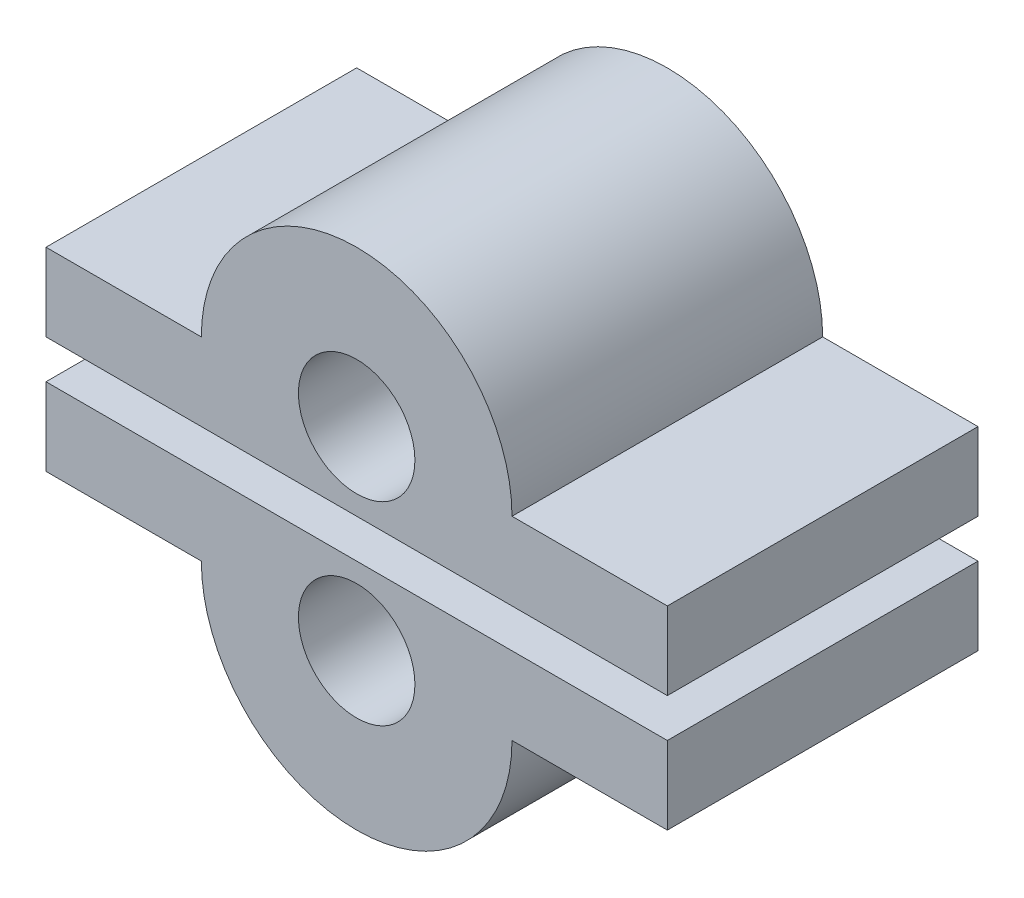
SolidWorks part; units mm, degrees
ref_plane "Front Plane" through (0, 0, 0) normal (0, 0, 1) x (1, 0, 0)
ref_plane "Top Plane" through (0, 0, 0) normal (0, 1, 0) x (1, 0, 0)
ref_plane "Right Plane" through (0, 0, 0) normal (1, 0, 0) x (0, 0, -1)
sketch "Sketch1" plane through (0, 0, 0) normal (0, 0, 1) x (1, 0, 0)
  line L0 (0, 0) -> (80, 0) construction
  line L1 (80, -12.5) -> (80, 12.5)
  line L2 (80, 12.5) -> (60, 12.5)
  line L3 (20, 12.5) -> (0, 12.5)
  line L4 (0, 12.5) -> (0, -12.5)
  line L5 (20, -12.5) -> (0, -12.5)
  line L6 (80, -12.5) -> (60, -12.5)
  arc A0 (60, 12.5) -> (20, 12.5) centre (40, 12.5) ccw
  arc A1 (60, -12.5) -> (20, -12.5) centre (40, -12.5) cw
  circle A2 centre (40, 12.5) radius 7.5
  circle A3 centre (40, -12.5) radius 7.5
  dimension "D1" = 15
  dimension "D4" = 20
  dimension "D2" = 25
  dimension "D3" = 40
extrude "Extrude1" add sketch "Sketch1" along normal mid plane 40
sketch "Sketch2" plane through (0, 0, 0) normal (0, 0, 1) x (1, 0, 0)
  line L0 (0, 0) -> (80, 0) construction
  line L1 (80, -12.5) -> (80, 12.5) construction
  line L2 (0, -2.5) -> (0, 2.5)
  line L3 (0, 12.5) -> (0, -12.5) construction
  line L4 (0, 2.5) -> (80, 2.5)
  line L5 (80, 2.5) -> (80, -2.5)
  line L6 (0, -2.5) -> (80, -2.5)
  dimension "D1" = 5
extrude "Cut-Extrude1" cut sketch "Sketch2" against normal mid plane 40
